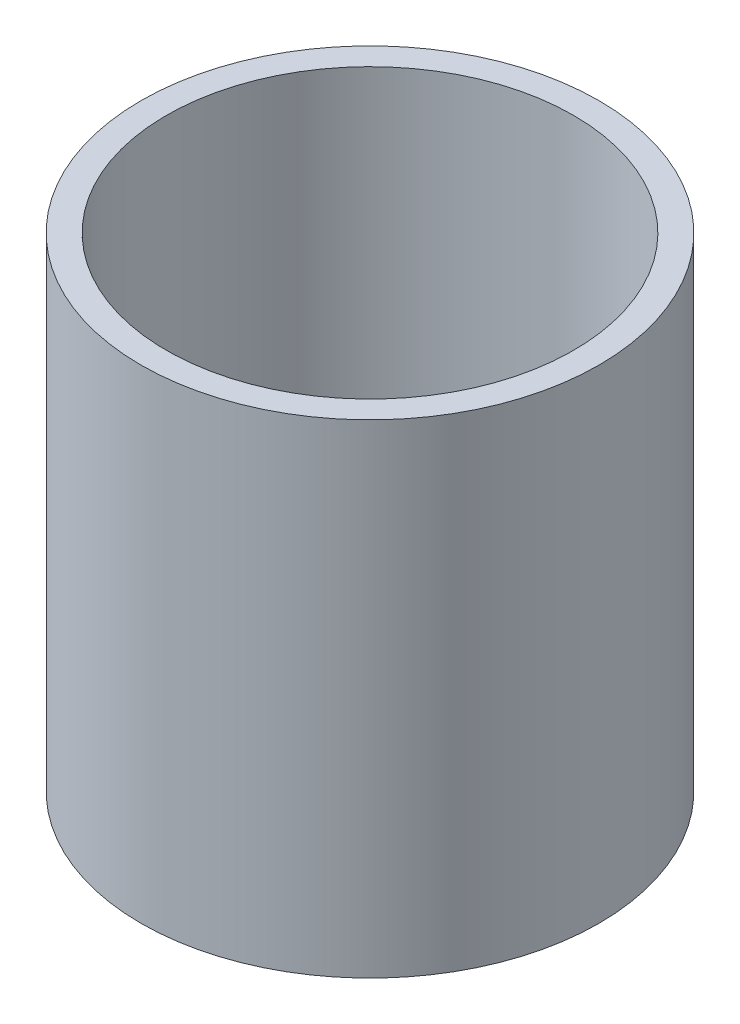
SolidWorks part; units mm, degrees
ref_plane "Front Plane" through (0, 0, 0) normal (0, 0, 1) x (1, 0, 0)
ref_plane "Top Plane" through (0, 0, 0) normal (0, 1, 0) x (1, 0, 0)
ref_plane "Right Plane" through (0, 0, 0) normal (1, 0, 0) x (0, 0, -1)
sketch "Sketch1" plane through (0, 0, 0) normal (0, 0, 1) x (1, 0, 0)
  line L0 (12.7, 0) -> (12.7, 30.1625)
  line L1 (12.7, 30.1625) -> (14.2875, 30.1625)
  line L2 (14.2875, 30.1625) -> (14.2875, 0)
  line L3 (14.2875, 0) -> (12.7, 0)
  line L4 (0, 0) -> (0, 58.8212) construction
  dimension "D1" = 25.4
  dimension "D2" = 28.575
  dimension "D3" = 30.1625
revolve "Revolve1" add sketch "Sketch1" angle 360 about L4
